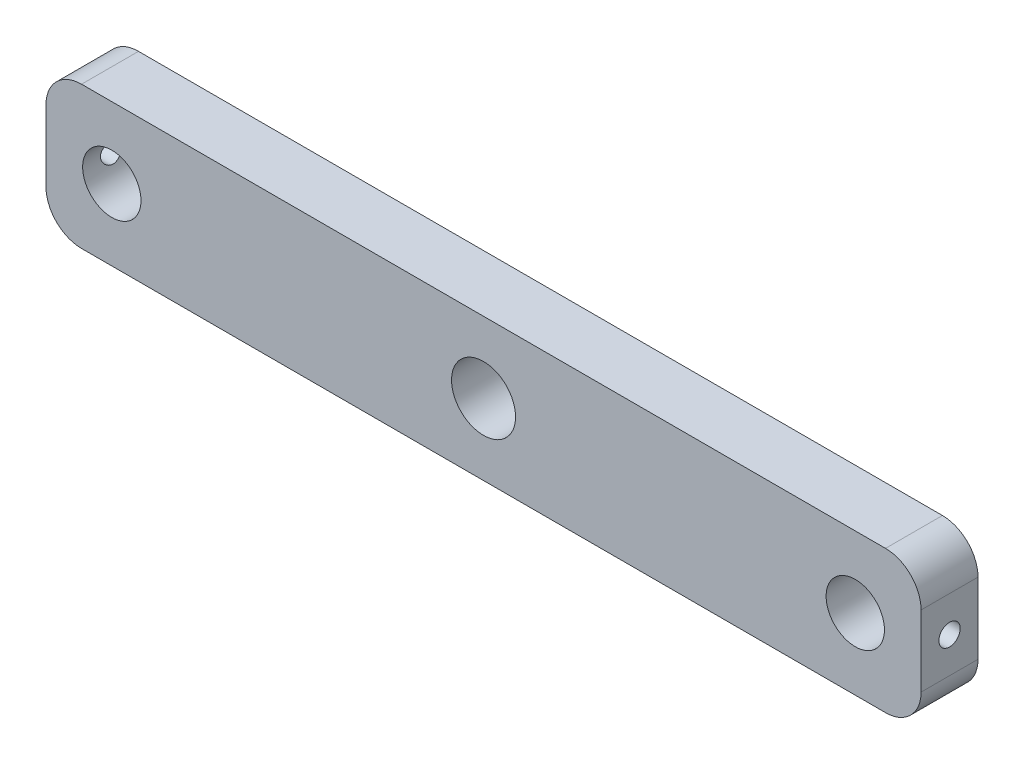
SolidWorks part; units mm, degrees
ref_plane "Front Plane" through (0, 0, 0) normal (0, 0, 1) x (1, 0, 0)
ref_plane "Top Plane" through (0, 0, 0) normal (0, 1, 0) x (1, 0, 0)
ref_plane "Right Plane" through (0, 0, 0) normal (1, 0, 0) x (0, 0, -1)
sketch "Sketch1" plane through (0, 0, 0) normal (0, 0, 1) x (1, 0, 0)
  line L1 (0, 0) -> (-123, 0)
  line L2 (0, 0) -> (0, 20)
  line L3 (0, 20) -> (-123, 20)
  line L4 (-123, 0) -> (-123, 20)
  circle A0 centre (-113.75, 10) radius 4.1
  circle A1 centre (-61.5, 10) radius 4.5
  circle A2 centre (-9.25, 10) radius 4.1
  point P5 (-113.75, 10)
  point P6 (-61.5, 10)
  point P7 (-9.25, 10)
  dimension "D5" = 20
  dimension "D7" = 8.2
  dimension "D8" = 9
  dimension "D9" = 8.2
  dimension "D1" = 123
  dimension "D2" = 104.5
  dimension "D3" = 9.25
  dimension "D4" = 52.25
  dimension "D6" = 10
extrude "Boss-Extrude1" add sketch "Sketch1" along normal blind 8
fillet "Fillet1" radius 5 1 edges at (-123, 20, 4)
fillet "Fillet2" radius 5 3 edges at (0, 20, 4) (0, 0, 4) (-123, 0, 4)
sketch "Sketch2" plane through (-123, 0, 0) normal (-1, 0, 0) x (0, 0, 1)
  line L0 (0, 20) -> (8, 20) construction
  line L2 (0, 15) -> (0, 5) construction
  circle A0 centre (4, 10) radius 1.5
  dimension "D1" = 3
  dimension "D2" = 10
  dimension "D3" = 4
extrude "Cut-Extrude1" cut sketch "Sketch2" against normal up to next
sketch "Sketch3" plane through (0, 0, 0) normal (1, 0, 0) x (0, 0, -1)
  line L0 (-8, 20) -> (0, 20) construction
  line L1 (-8, 5) -> (-8, 15) construction
  circle A0 centre (-4, 10) radius 1.5
  dimension "D1" = 3
  dimension "D2" = 10
  dimension "D3" = 4
extrude "Cut-Extrude2" cut sketch "Sketch3" against normal up to next
